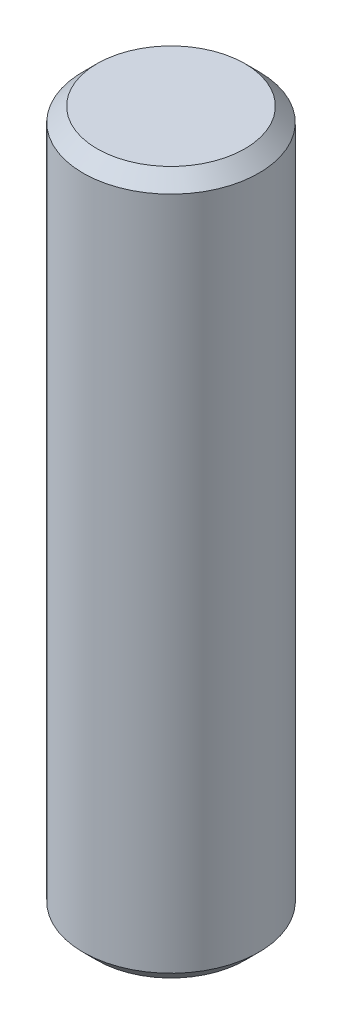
SolidWorks part; units mm, degrees
ref_plane "Front Plane" through (0, 0, 0) normal (0, 0, 1) x (1, 0, 0)
ref_plane "Top Plane" through (0, 0, 0) normal (0, 1, 0) x (1, 0, 0)
ref_plane "Right Plane" through (0, 0, 0) normal (1, 0, 0) x (0, 0, -1)
sketch "Sketch1" plane through (0, 0, 0) normal (0, 1, 0) x (1, 0, 0)
  circle A0 centre (0, 0) radius 4.765
  dimension "D1" = 9.5301
extrude "Extrude1" add sketch "Sketch1" along normal mid plane 38.1
chamfer "Chamfer1" distance 0.762 angle 45 2 edges at (0, -19.05, 4.765) (0, 19.05, 4.765)
